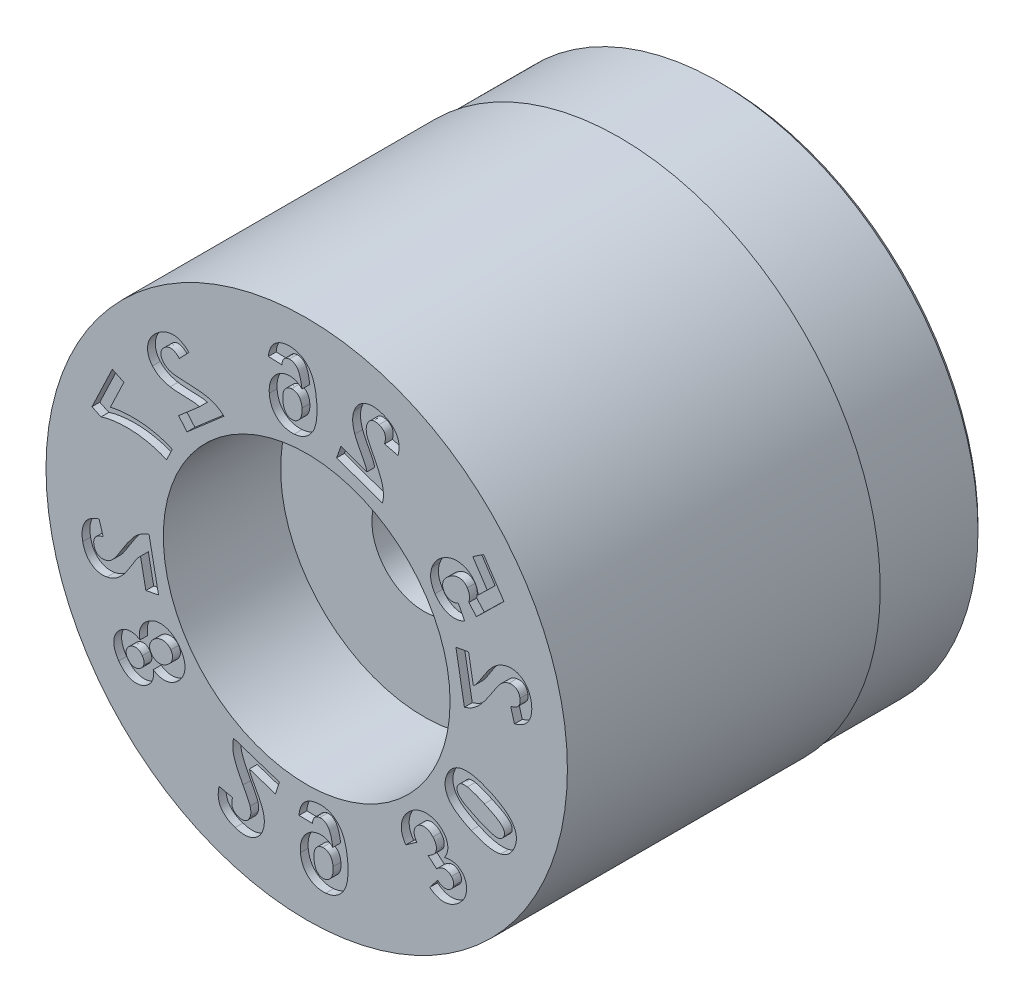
SolidWorks part; units mm, degrees
ref_plane "Front Plane" through (0, 0, 0) normal (0, 0, 1) x (1, 0, 0)
ref_plane "Top Plane" through (0, 0, 0) normal (0, 1, 0) x (1, 0, 0)
ref_plane "Right Plane" through (0, 0, 0) normal (1, 0, 0) x (0, 0, -1)
sketch "Sketch1" plane through (0, 0, 0) normal (1, 0, 0) x (0, 0, -1)
  line L2 (0, 10) -> (0, 5.5)
  line L3 (15.75, 10) -> (0, 10)
  line L4 (-3.7979, 0) -> (49996.2021, 0) construction
  line L8 (16, 2) -> (4.5, 2)
  line L9 (4.5, 5.5) -> (4.5, 2)
  line L10 (4.5, 5.5) -> (0, 5.5)
  line L12 (16, 2) -> (16, 9.75)
  line L16 (16, 9.75) -> (15.75, 10)
  dimension "D1" = 16
  dimension "D2" = 45
  dimension "D3" = 0.25
  dimension "D4" = 20
  dimension "D5" = 11
  dimension "D6" = 4.5
  dimension "D7" = 4
revolve "Revolve1" add sketch "Sketch1" angle 360 about L4
sketch "Sketch4" plane through (0, 0, 0) normal (1, 0, 0) x (0, 0, -1)
  line L0 (0, 0) -> (50000, 0) construction
  line L1 (16, -9.75) -> (16, 9.75) construction
  line L2 (12, 10.935) -> (16, 10.935)
  line L3 (12, 10.935) -> (12, 9.935)
  line L4 (12, 9.935) -> (16, 9.935)
  line L5 (16, 10.935) -> (16, 9.935)
  line L6 (15.75, 10) -> (0, 10) construction
  line L9 (0, 11) -> (0, -11) construction
  dimension "D1" = 1
  dimension "D2" = 0.065
  dimension "D3" = 12
revolve "Cut-Revolve1" cut sketch "Sketch4" angle 360 about L0
sketch "Sketch6" plane through (0, 0, 0) normal (0, 0, 1) x (1, 0, 0)
  circle A0 centre (0, 0) radius 6.0672 construction
  text T0 "25 26 27 28 29 30" font "Arial" height 2.8
extrude "Cut-Extrude1" cut sketch "Sketch6" against normal blind 0.3
